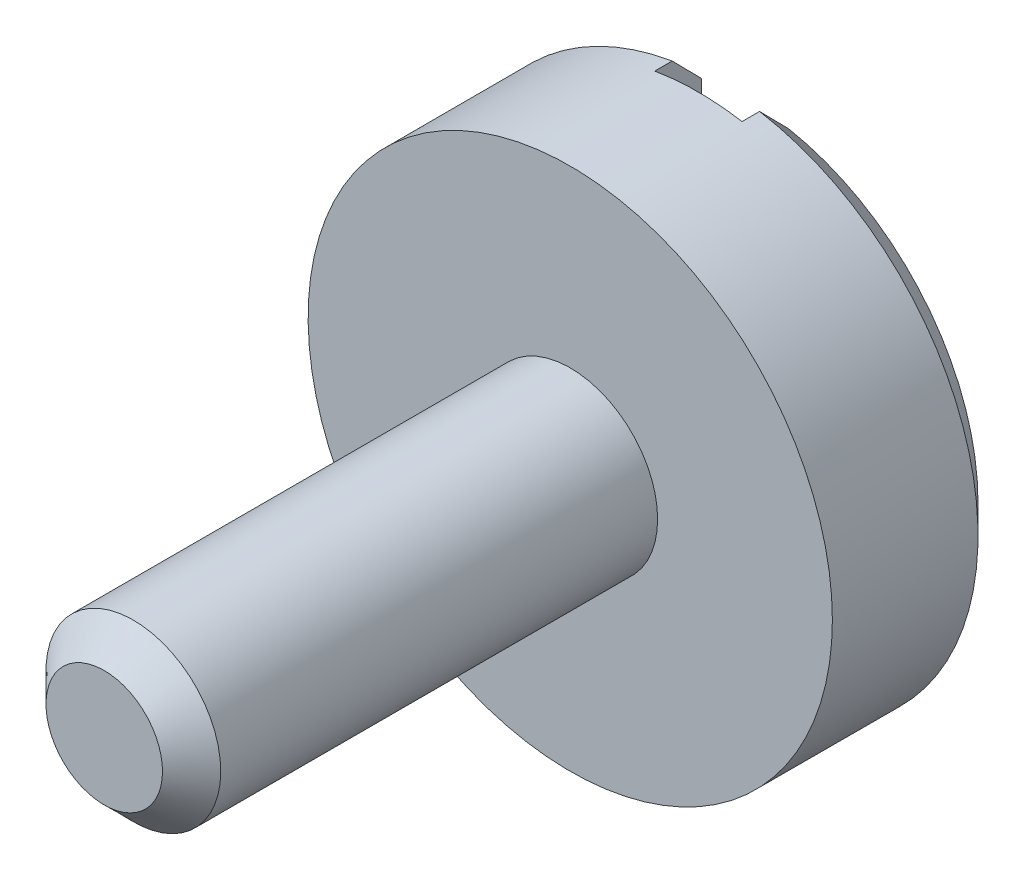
SolidWorks part; units mm, degrees
ref_plane "Plan de face" through (0, 0, 0) normal (0, 0, 1) x (1, 0, 0)
ref_plane "Plan de dessus" through (0, 0, 0) normal (0, 1, 0) x (1, 0, 0)
ref_plane "Plan de droite" through (0, 0, 0) normal (1, 0, 0) x (0, 0, -1)
sketch "Esquisse1" plane through (0, 0, 0) normal (0, 0, 1) x (1, 0, 0)
  circle A0 centre (0, 0) radius 4.5
extrude "Extrusion1" add sketch "Esquisse1" along normal blind 3
sketch "Esquisse2" plane through (0, 0, 3) normal (0, 0, 1) x (1, 0, 0)
  circle A0 centre (0, 0) radius 1.5
extrude "Extrusion2" add sketch "Esquisse2" along normal blind 8
chamfer "Chanfrein1" distance 0.5 angle 45 1 edges at (4.5, 0, 0)
sketch "Esquisse3" plane through (0, 0, 0) normal (0, 0, -1) x (-1, 0, 0)
  line L1 (-0.75, 4.824) -> (0.75, 4.824)
  line L2 (-0.75, 4.824) -> (-0.75, -4.984)
  line L3 (-0.75, -4.984) -> (0.75, -4.984)
  line L4 (0.75, 4.824) -> (0.75, -4.984)
  dimension "D1" = 0.75
  dimension "D2" = 1.5
extrude "Enlèv. mat.-Extru.1" cut sketch "Esquisse3" against normal blind 0.8
chamfer "Chanfrein2" distance 0.5 angle 45 1 edges at (1.5, 0, 11)
